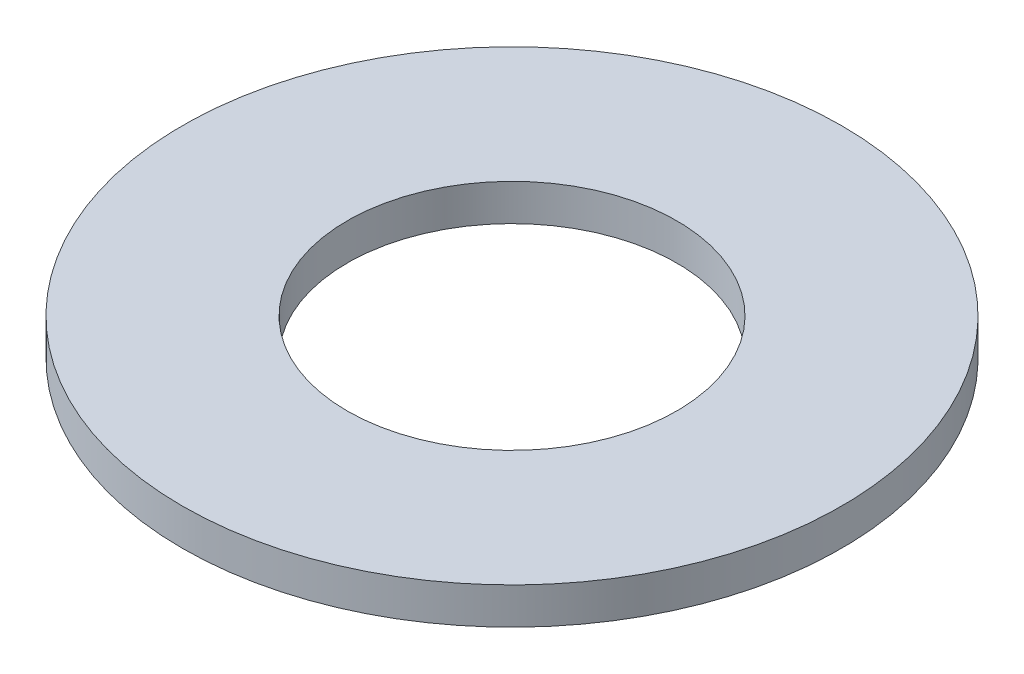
SolidWorks part; units mm, degrees
ref_plane "Front" through (0, 0, 0) normal (0, 0, 1) x (1, 0, 0)
ref_plane "Top" through (0, 0, 0) normal (0, 1, 0) x (1, 0, 0)
ref_plane "Right" through (0, 0, 0) normal (1, 0, 0) x (0, 0, -1)
sketch "Sketch1" plane through (0, 0, 0) normal (0, 1, 0) x (1, 0, 0)
  circle A0 centre (0, 0) radius 4.5
  dimension "D1" = 9
extrude "Base-Extrude" add sketch "Sketch1" along normal blind 0.5
sketch "Sketch2" plane through (0, 0.5, 0) normal (0, 1, 0) x (-1, 0, 0)
  circle A0 centre (0, 0) radius 2.25
  circle A1 centre (0, 0) radius 4.5 construction
  dimension "D1" = 4.5
extrude "Cut-Extrude1" cut sketch "Sketch2" against normal through all
